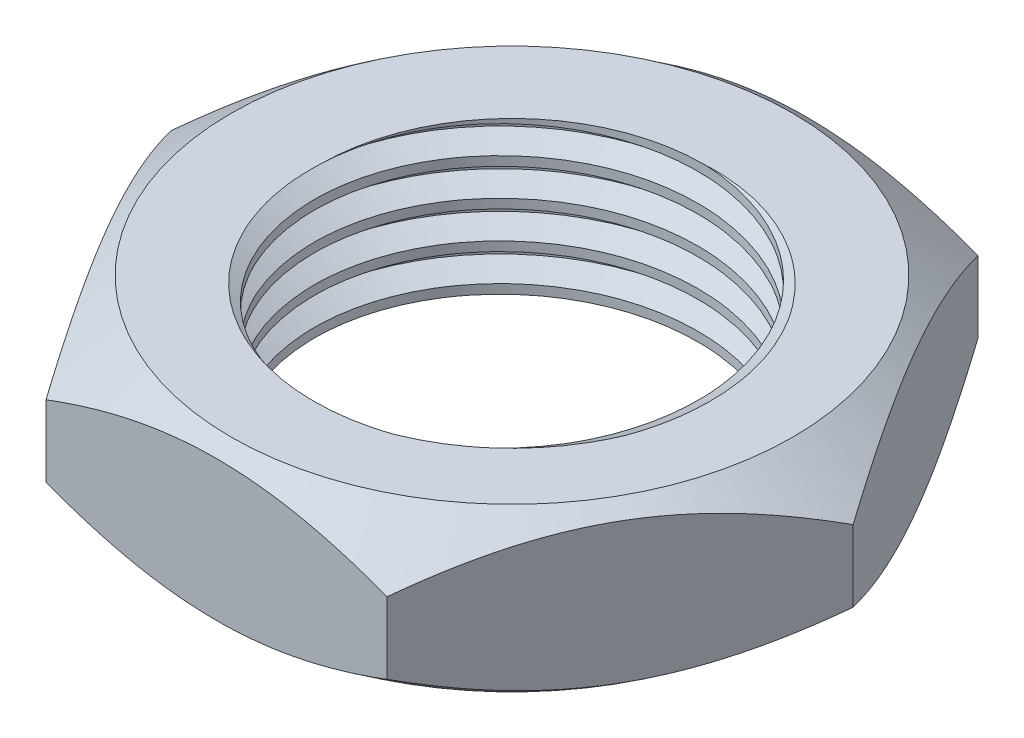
SolidWorks part; units mm, degrees
ref_plane "Front Plane" through (0, 0, 0) normal (0, 0, 1) x (1, 0, 0)
ref_plane "Top Plane" through (0, 0, 0) normal (0, 1, 0) x (1, 0, 0)
ref_plane "Right Plane" through (0, 0, 0) normal (1, 0, 0) x (0, 0, -1)
sketch "Sketch1" plane through (0, 0, 0) normal (0, 1, 0) x (1, 0, 0)
  line L1 (-4.6188, 0) -> (-2.3094, -4)
  line L2 (-2.3094, -4) -> (2.3094, -4)
  line L3 (2.3094, -4) -> (4.6188, 0)
  line L4 (4.6188, 0) -> (2.3094, 4)
  line L5 (2.3094, 4) -> (-2.3094, 4)
  line L6 (-2.3094, 4) -> (-4.6188, 0)
  circle A0 centre (0, 0) radius 4 construction
  circle A1 centre (0, 0) radius 2.6
  dimension "D2" = 5.2
  dimension "D1" = 8
extrude "Boss-Extrude1" add sketch "Sketch1" along normal blind 2.2
thread "Thread1" pitch 0.5 start angle 0, offset 0.5, length 0, pitch 0.5, diameter 5.2
ref_plane "Plane1" through (-2.6, 2.7, 0) normal (0, 0, 1) x (-1, 0, 0)
sketch "Thread Profile1" plane through (-2.6, 2.7, 0) normal (0, 0, 1) x (-1, 0, 0)
  line L0 (0, 0) -> (0, 0.5) construction
  line L1 (0, 0) -> (0.2706, 0.1562)
  line L2 (0.2706, 0.1562) -> (0.2706, 0.2187)
  line L3 (0.2706, 0.2187) -> (0, 0.375)
  line L4 (0.2706, 0.1875) -> (0, 0.1875) construction
  line L11 (0, 0) -> (0, 0.375)
  point P2 (0, 0)
  dimension "Pitch" = 0.5
  dimension "Profile_Angle" = 60
  dimension "Profile_Land" = 0.0625
  dimension "Profile_Height" = 0.2706
sketch "Sketch4" plane through (0, 0, 0) normal (1, 0, 0) x (0, 0, -1)
  line L0 (-3.8, 2.2) -> (-5.2635, 1.1)
  line L1 (-4, 2.2) -> (0, 2.2) construction
  line L2 (-5.2635, 1.1) -> (-3.8, 0)
  line L3 (-4, 0) -> (0, 0) construction
  line L4 (-3.8, 0) -> (-5.9262, 0)
  line L5 (-5.9262, 0) -> (-5.9262, 2.2)
  line L6 (-5.9262, 2.2) -> (-3.8, 2.2)
  line L7 (0, 0) -> (0, 2.2) construction
  point P13 (0, 0)
  point P14 (0, 0)
  point P15 (0, 1.1)
  dimension "D1" = 3.8
revolve "Cut-Revolve1" cut sketch "Sketch4" angle 360 about L7
